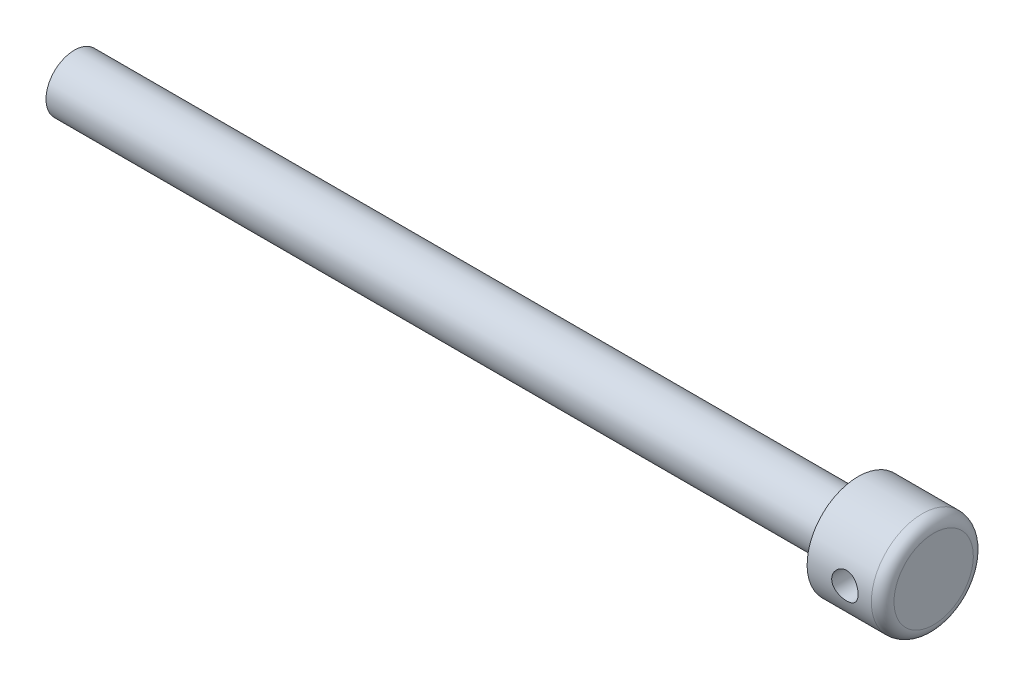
SolidWorks part; units mm, degrees
ref_plane "Front Plane" through (0, 0, 0) normal (0, 0, 1) x (1, 0, 0)
ref_plane "Top Plane" through (0, 0, 0) normal (0, 1, 0) x (1, 0, 0)
ref_plane "Right Plane" through (0, 0, 0) normal (1, 0, 0) x (0, 0, -1)
sketch "Sketch1" plane through (192.5, 0, 0) normal (1, 0, 0) x (0, 0, -1)
  circle A0 centre (0, 139) radius 15 construction
  circle A1 centre (0, 139) radius 15
extrude "Boss-Extrude1" add sketch "Sketch1" against normal blind 415
sketch "Sketch3" plane through (192.5, 0, 0) normal (1, 0, 0) x (0, 0, -1)
  circle A0 centre (0, 139) radius 27
  dimension "D1" = 54
extrude "Boss-Extrude2" add sketch "Sketch3" along normal blind 40
sketch "Sketch4" plane through (0, 0, 0) normal (0, 0, 1) x (1, 0, 0)
  line L0 (232.5, 112) -> (232.5, 166) construction
  line L1 (232.5, 139) -> (174.8771, 139) construction
  circle A0 centre (212.5, 139) radius 7
  dimension "D1" = 14
  dimension "D2" = 20
extrude "Cut-Extrude1" cut sketch "Sketch4" against normal through all both and the other way through all
fillet "Fillet1" radius 6 1 edges at (232.5, 166, 0)
